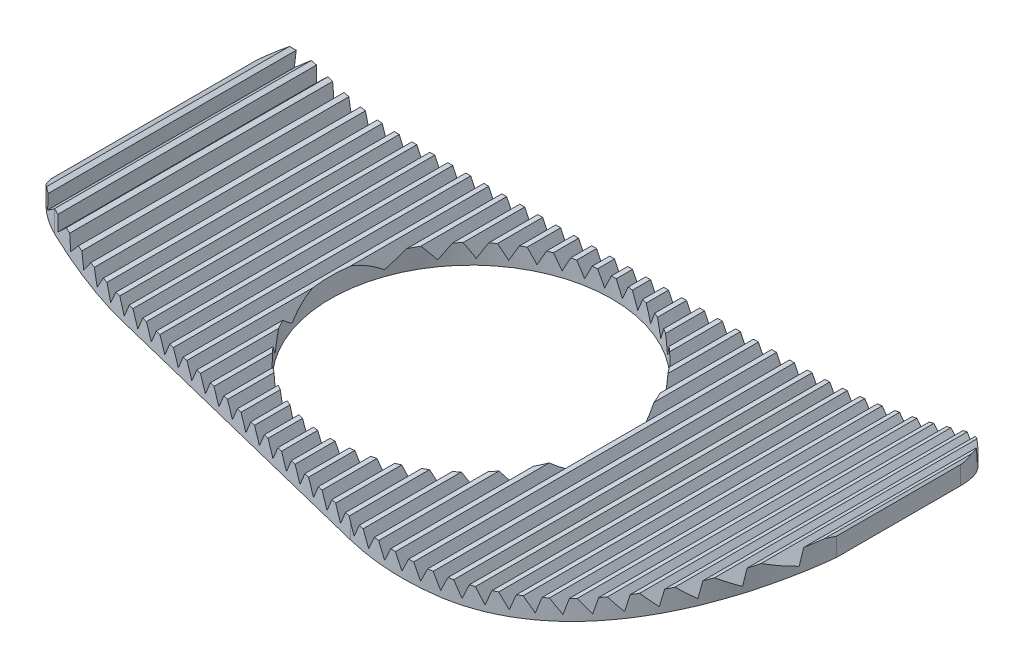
SolidWorks part; units mm, degrees
other "<Binding Pad>-<Cut-Extrude4>"
ref_plane "Front Plane" through (0, 0, 0) normal (0, 0, 1) x (1, 0, 0)
ref_plane "Top Plane" through (0, 0, 0) normal (0, 1, 0) x (1, 0, 0)
ref_plane "Right Plane" through (0, 0, 0) normal (1, 0, 0) x (0, 0, -1)
mirrored part "Binding Pad_Mirrored"
